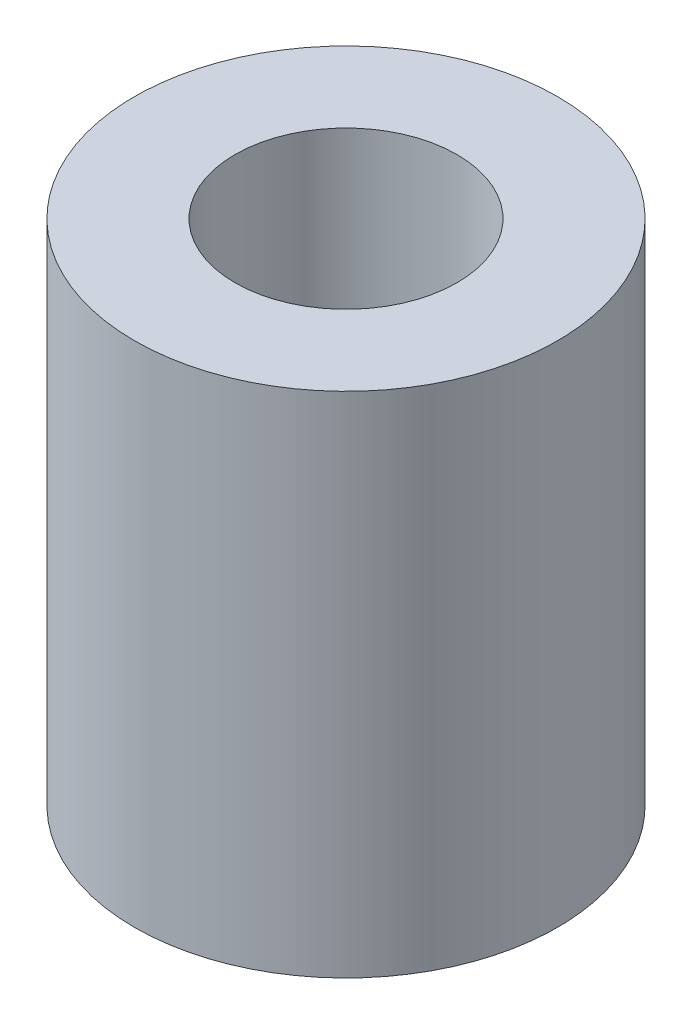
SolidWorks part; units mm, degrees
ref_plane "Front Plane" through (0, 0, 0) normal (0, 0, 1) x (1, 0, 0)
ref_plane "Top Plane" through (0, 0, 0) normal (0, 1, 0) x (1, 0, 0)
ref_plane "Right Plane" through (0, 0, 0) normal (1, 0, 0) x (0, 0, -1)
sketch "Sketch1" plane through (0, 0, 0) normal (0, 1, 0) x (1, 0, 0)
  circle A0 centre (0, 0) radius 4
  circle A1 centre (0, 0) radius 2.1
  dimension "D1" = 4.2
  dimension "D2" = 8
extrude "Boss-Extrude1" add sketch "Sketch1" along normal blind 9.61
